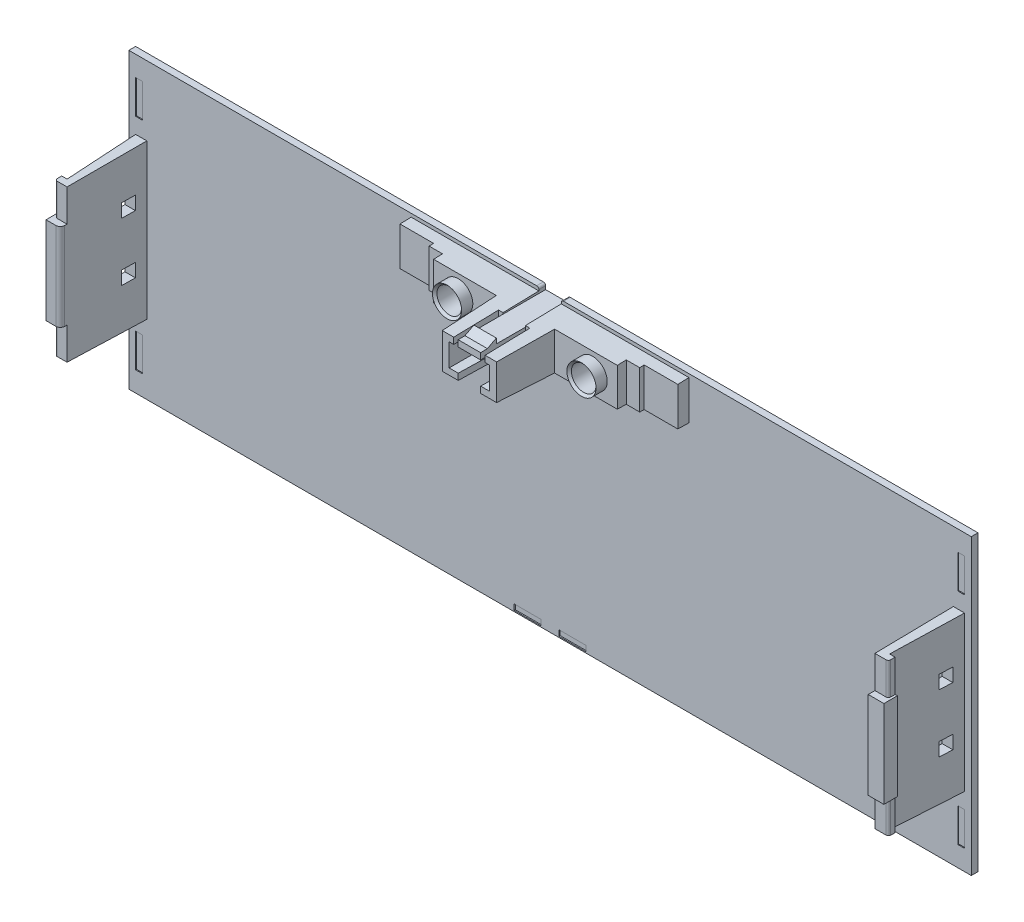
SolidWorks part; units mm, degrees
ref_plane "Plan de face" through (0, 0, 0) normal (0, 0, 1) x (1, 0, 0)
ref_plane "Plan de dessus" through (0, 0, 0) normal (0, 1, 0) x (1, 0, 0)
ref_plane "Plan de droite" through (0, 0, 0) normal (1, 0, 0) x (0, 0, -1)
sketch "Esquisse1" plane through (0, 0, 0) normal (0, 0, 1) x (1, 0, 0)
  line L1 (-94, 32.75) -> (94, 32.75)
  line L2 (-94, 32.75) -> (-94, -32.75)
  line L3 (-94, -32.75) -> (94, -32.75)
  line L4 (94, 32.75) -> (94, -32.75)
  dimension "D1" = 188
  dimension "D2" = 65.5
  dimension "D3" = 94
  dimension "D4" = 32.75
extrude "Extrusion1" add sketch "Esquisse1" along normal blind 1.5
sketch "Esquisse2" plane through (0, 0, 1.5) normal (0, 0, 1) x (1, 0, 0)
  line L0 (0, 49.1948) -> (0, -57.6715) construction
  line L1 (93.5, -17.25) -> (90, -17.25)
  line L2 (-93.5, 17.25) -> (-90, 17.25)
  line L3 (-93.5, 17.25) -> (-93.5, -17.25)
  line L4 (-93.5, -17.25) -> (-90, -17.25)
  line L5 (-90, 17.25) -> (-90, -17.25)
  line L6 (90, 17.25) -> (90, -17.25)
  line L7 (93.5, 17.25) -> (90, 17.25)
  line L8 (93.5, 17.25) -> (93.5, -17.25)
  dimension "D1" = 3.5
  dimension "D2" = 34.5
  dimension "D3" = 90
  dimension "D4" = 17.25
extrude "Extrusion2" add sketch "Esquisse2" along normal blind 19
sketch "Esquisse3" plane through (-93.5, 0, 0) normal (-1, 0, 0) x (0, 0, 1)
  line L0 (34.0005, 0) -> (-10.2246, 0) construction
  line L1 (1.5, 32.75) -> (1.5, -32.75) construction
  line L2 (4, 8) -> (7, 8)
  line L3 (4, 8) -> (4, 5)
  line L4 (4, 5) -> (7, 5)
  line L5 (7, 8) -> (7, 5)
  line L6 (7, -8) -> (7, -5)
  line L7 (4, -5) -> (7, -5)
  line L8 (4, -8) -> (7, -8)
  line L9 (4, -8) -> (4, -5)
  dimension "D1" = 3
  dimension "D2" = 3
  dimension "D3" = 10
  dimension "D4" = 2.5
extrude "Enlèv. mat.-Extru.1" cut sketch "Esquisse3" against normal through all
sketch "Esquisse4" plane through (0, 0, 1.5) normal (0, 0, 1) x (1, 0, 0)
  line L0 (94, 32.75) -> (-94, 32.75) construction
  line L1 (-31, 32) -> (31, 32)
  line L2 (-31, 32) -> (-31, 23.25)
  line L3 (-31, 23.25) -> (31, 23.25)
  line L4 (31, 32) -> (31, 23.25)
  dimension "D1" = 8.75
  dimension "D2" = 62
  dimension "D3" = 31
  dimension "D4" = 0.75
sketch "Esquisse5" plane through (-93.5, 0, 0) normal (-1, 0, 0) x (0, 0, 1)
  line L0 (26.7662, 0) -> (26.9026, 0) construction
  line L1 (26.9026, 0) -> (-9.5421, 0) construction
  line L2 (20.5, 17.25) -> (20.5, -17.25) construction
  line L3 (19, 19.75) -> (25.0059, 19.75)
  line L4 (19, 19.75) -> (19, 9.75)
  line L5 (19, 9.75) -> (25.0059, 9.75)
  line L6 (25.0059, 19.75) -> (25.0059, 9.75)
  line L7 (25.0059, -19.75) -> (25.0059, -9.75)
  line L8 (19, -9.75) -> (25.0059, -9.75)
  line L9 (19, -19.75) -> (25.0059, -19.75)
  line L10 (19, -19.75) -> (19, -9.75)
  dimension "D1" = 9.75
  dimension "D2" = 10
  dimension "D3" = 6.0059
  dimension "D4" = 1.5
extrude "Enlèv. mat.-Extru.2" cut sketch "Esquisse5" against normal through all
draft "Dépouille1" type of draft neutral plane draft angle 1 faces to draft 1 parameters "D1"=1
fillet "Congé2" radius 1 1 edges at (-90.3316, 0, 20.5)
sketch "Esquisse6" plane through (0, -17.25, 0) normal (0, -1, 0) x (1, 0, 0)
  line L0 (-92.5, 1.5) -> (-91.7795, 17.5)
  line L1 (-94, 1.5) -> (94, 1.5) construction
  line L2 (-91.7795, 17.5) -> (-93.5, 17.5)
  line L3 (-93.5, 19) -> (-93.5, 1.5) construction
  line L4 (-93.5, 17.5) -> (-93.5, 1.5)
  line L5 (-93.5, 1.5) -> (-92.5, 1.5)
  line L6 (-90.3055, 19) -> (-90, 1.5) construction
  line L8 (-91.3143, 20.5) -> (-93.5, 20.5) construction
  line L9 (0, -24.7431) -> (0, 42.7766) construction
  line L10 (93.5, 1.5) -> (92.5, 1.5)
  line L11 (92.5, 1.5) -> (91.7795, 17.5)
  line L12 (93.5, 17.5) -> (93.5, 1.5)
  line L13 (91.7795, 17.5) -> (93.5, 17.5)
  dimension "D1" = 1
  dimension "D2" = 1.5
  dimension "D3" = 3
extrude "Enlèv. mat.-Extru.5" cut sketch "Esquisse6" against normal through all
sketch "Esquisse7" plane through (0, -17.25, 0) normal (0, -1, 0) x (1, 0, 0)
  line L0 (0, -5.9465) -> (0, 53.0874) construction
  line L1 (-90.3055, 19) -> (-93.5, 19) construction
  line L2 (-93, 19) -> (-94.3654, 19)
  line L3 (-93, 19) -> (-93, 17.2978)
  line L4 (-93, 17.2978) -> (-94.3654, 17.2978)
  line L5 (-94.3654, 19) -> (-94.3654, 17.2978)
  line L6 (-93.5, 19) -> (-93.5, 17.5) construction
  line L7 (93, 19) -> (93, 17.2978)
  line L8 (93, 17.2978) -> (94.3654, 17.2978)
  line L9 (94.3654, 19) -> (94.3654, 17.2978)
  line L10 (93, 19) -> (94.3654, 19)
  point P9 (-93.5, 18.25)
  dimension "D1" = 1.7022
  dimension "D2" = 0.5
  dimension "D3" = 1.3654
extrude "Enlèv. mat.-Extru.6" cut sketch "Esquisse7" against normal blind 7.5
sketch "Esquisse8" plane through (0, 17.25, 0) normal (0, 1, 0) x (-1, 0, 0)
  line L0 (-90, 19) -> (-93.5, 19) construction
  line L1 (-93, 19) -> (-93.8429, 19)
  line L2 (-93, 19) -> (-93, 16.5648)
  line L3 (-93, 16.5648) -> (-93.8429, 16.5648)
  line L4 (-93.8429, 19) -> (-93.8429, 16.5648)
  line L5 (-93.5, 19) -> (-93.5, 17.5) construction
  line L6 (0, 0) -> (0, 56.5796) construction
  line L7 (93, 16.5648) -> (93.8429, 16.5648)
  line L8 (93, 19) -> (93, 16.5648)
  line L9 (93, 19) -> (93.8429, 19)
  line L10 (93.8429, 19) -> (93.8429, 16.5648)
  dimension "D1" = 2.4352
  dimension "D2" = 0.5
  dimension "D3" = 0.8429
extrude "Enlèv. mat.-Extru.7" cut sketch "Esquisse8" against normal blind 7.5
fillet "Congé3" radius 0.5 2 edges at (-93, 13.5, 19) (-93, -13.5, 19)
draft "Dépouille2" type of draft neutral plane draft angle 1 faces to draft 1 parameters "D1"=1
draft "Dépouille3" type of draft neutral plane draft angle 1 faces to draft 1 parameters "D1"=1
draft "Dépouille4" type of draft neutral plane draft angle 1 faces to draft 1 parameters "D1"=1
draft "Dépouille5" type of draft neutral plane draft angle 1 faces to draft 1 parameters "D1"=1
fillet "Congé4" radius 0.5 1 edges at (93, 13.3473, 19)
fillet "Congé5" radius 0.5 1 edges at (93, -13.3473, 19)
sketch "Esquisse9" plane through (0, 0, 1.5) normal (0, 0, 1) x (1, 0, 0)
  line L0 (0, 0) -> (0, -46.1675) construction
  line L1 (-94, -32.75) -> (94, -32.75) construction
  line L2 (-8, -31.25) -> (-2, -31.25)
  line L3 (-8, -31.25) -> (-8, -32.5)
  line L4 (-8, -32.5) -> (-2, -32.5)
  line L5 (-2, -31.25) -> (-2, -32.5)
  line L6 (2, -31.25) -> (2, -32.5)
  line L7 (8, -31.25) -> (2, -31.25)
  line L8 (8, -31.25) -> (8, -32.5)
  line L9 (8, -32.5) -> (2, -32.5)
  dimension "D1" = 1.25
  dimension "D2" = 6
  dimension "D3" = 0.25
  dimension "D4" = 2
extrude "Enlèv. mat.-Extru.8" cut sketch "Esquisse9" against normal blind 0.25
extrude "Extrusion3" add sketch "Esquisse4" along normal blind 18 contours L2 L3 L4 L1
sketch "Esquisse10" plane through (0, 23.25, 0) normal (0, -1, 0) x (1, 0, 0)
  line L0 (0, 28.6532) -> (0, -3.2422) construction
  line L1 (31, 4) -> (31, 19.5)
  line L2 (31, 19.5) -> (31, 1.5) construction
  line L3 (31, 4) -> (23.5, 4)
  line L4 (23.5, 4) -> (23.5, 5)
  line L5 (23.5, 5) -> (20.5, 5)
  line L6 (20.5, 5) -> (20.5, 7)
  line L7 (20.5, 7) -> (6.5, 7)
  line L8 (6.5, 7) -> (6.5, 19.5)
  line L9 (-31, 19.5) -> (31, 19.5) construction
  line L10 (31, 19.5) -> (6.5, 19.5)
  line L11 (-94, 1.5) -> (94, 1.5) construction
  line L12 (-31, 19.5) -> (-6.5, 19.5)
  line L13 (-6.5, 7) -> (-6.5, 19.5)
  line L14 (-20.5, 7) -> (-6.5, 7)
  line L15 (-20.5, 5) -> (-20.5, 7)
  line L16 (-31, 4) -> (-31, 19.5)
  line L17 (-23.5, 5) -> (-20.5, 5)
  line L18 (-31, 4) -> (-23.5, 4)
  line L19 (-23.5, 4) -> (-23.5, 5)
  dimension "D1" = 7.5
  dimension "D2" = 14
  dimension "D3" = 3
  dimension "D4" = 5.5
  dimension "D5" = 3.5
  dimension "D6" = 2.5
extrude "Enlèv. mat.-Extru.9" cut sketch "Esquisse10" against normal through all
sketch "Esquisse11" plane through (0, 0, 7) normal (0, 0, 1) x (1, 0, 0)
  line L0 (0, 0) -> (0, 44.6077) construction
  line L1 (20.5, 32) -> (6.5, 32) construction
  line L2 (31, 32) -> (23.5, 32) construction
  circle A0 centre (15, 27.625) radius 3.25
  circle A1 centre (-15, 27.625) radius 3.25
  dimension "D1" = 6.5
  dimension "D2" = 15
  dimension "D3" = 4.375
extrude "Extrusion4" add sketch "Esquisse11" along normal blind 2.5
draft "Dépouille7" type of draft neutral plane draft angle 2 faces to draft 1 parameters "D1"=2
draft "Dépouille8" type of draft neutral plane draft angle 2 faces to draft 1 parameters "D1"=2
sketch "Esquisse17" plane through (0, 0, 0) normal (0, 0, -1) x (-1, 0, 0)
  line L0 (0, 0) -> (0, 40.1138) construction
  line L1 (-43.1897, 27.625) -> (8.6403, 27.625) construction
  line L2 (-94, 32.75) -> (94, 32.75) construction
  line L3 (24.5, 30.625) -> (24.5, 24.625)
  line L4 (-29.5, 30.625) -> (-24.5, 30.625)
  line L5 (-29.5, 30.625) -> (-29.5, 24.625)
  line L6 (-29.5, 24.625) -> (-24.5, 24.625)
  line L7 (-24.5, 30.625) -> (-24.5, 24.625)
  line L8 (29.5, 24.625) -> (24.5, 24.625)
  line L9 (29.5, 30.625) -> (24.5, 30.625)
  line L10 (29.5, 30.625) -> (29.5, 24.625)
  dimension "D1" = 5.125
  dimension "D2" = 5
  dimension "D3" = 6
  dimension "D4" = 3
  dimension "D5" = 24.5
extrude "Enlèv. mat.-Extru.17" cut sketch "Esquisse17" against normal blind 2.5
sketch "Esquisse18" plane through (0, 0, 0) normal (0, 0, -1) x (-1, 0, 0)
  line L0 (0, 0) -> (0, 42.2606) construction
  line L1 (-27.4464, 27.625) -> (4.1422, 27.625) construction
  line L3 (-94, 32.75) -> (94, 32.75) construction
  line L4 (-24.5, 24.625) -> (-24.5, 30.625) construction
  line L5 (-23.5, 30.625) -> (-6.5, 30.625)
  line L6 (-23.5, 30.625) -> (-23.5, 24.625)
  line L7 (-23.5, 24.625) -> (-6.5, 24.625)
  line L8 (-6.5, 30.625) -> (-6.5, 24.625)
  line L9 (6.5, 30.625) -> (6.5, 24.625)
  line L10 (23.5, 24.625) -> (6.5, 24.625)
  line L11 (23.5, 30.625) -> (6.5, 30.625)
  line L12 (23.5, 30.625) -> (23.5, 24.625)
  dimension "D1" = 5.125
  dimension "D2" = 1
  dimension "D3" = 17
  dimension "D4" = 6
  dimension "D5" = 3
extrude "Enlèv. mat.-Extru.18" cut sketch "Esquisse18" against normal blind 2.5
sketch "Esquisse19" plane through (0, 0, 2.5) normal (0, 0, -1) x (-1, 0, 0)
  line L0 (0, 0) -> (0, 41.545) construction
  line L1 (-24.5, 27.625) -> (2.5066, 27.625) construction
  line L2 (-24.5, 24.625) -> (-24.5, 30.625) construction
  line L3 (6.5, 30.625) -> (6.5, 24.625)
  line L4 (-22, 30.625) -> (-6.5, 30.625)
  line L5 (-22, 30.625) -> (-22, 24.625)
  line L6 (-22, 24.625) -> (-6.5, 24.625)
  line L7 (-6.5, 30.625) -> (-6.5, 24.625)
  line L8 (22, 30.625) -> (6.5, 30.625)
  line L9 (22, 24.625) -> (6.5, 24.625)
  line L10 (22, 30.625) -> (22, 24.625)
  dimension "D1" = 6
  dimension "D2" = 3
  dimension "D3" = 15.5
  dimension "D4" = 13
extrude "Enlèv. mat.-Extru.22" cut sketch "Esquisse19" against normal blind 1 contours L3 L9 L10 L8 | L5 L6 L7 L4
sketch "Esquisse21" plane through (0, 0, 3.5) normal (0, 0, -1) x (-1, 0, 0)
  line L0 (0, 0) -> (0, 30.8628) construction
  line L1 (-24.5, 27.625) -> (-3.4223, 27.625) construction
  line L2 (-24.5, 24.625) -> (-24.5, 30.625) construction
  line L3 (6.5, 30.625) -> (6.5, 24.625)
  line L4 (-19, 30.625) -> (-6.5, 30.625)
  line L5 (-19, 30.625) -> (-19, 24.625)
  line L6 (-19, 24.625) -> (-6.5, 24.625)
  line L7 (-6.5, 30.625) -> (-6.5, 24.625)
  line L8 (19, 24.625) -> (6.5, 24.625)
  line L9 (19, 30.625) -> (6.5, 30.625)
  line L10 (19, 30.625) -> (19, 24.625)
  dimension "D1" = 6
  dimension "D2" = 3
  dimension "D3" = 12.5
  dimension "D4" = 13
extrude "Enlèv. mat.-Extru.23" cut sketch "Esquisse21" against normal blind 1
fillet "Congé6" radius 1 1 edges
fillet "Congé7" radius 1 1 edges
fillet "Congé8" radius 1 1 edges
fillet "Congé9" radius 1 1 edges
draft "Dépouille9" type of draft neutral plane draft angle 1.4 faces to draft 1 parameters "D1"=1.4
draft "Dépouille10" type of draft neutral plane draft angle 1.4 faces to draft 1 parameters "D1"=1.4
sketch "Esquisse22" plane through (0, 0, 0) normal (0, 0, -1) x (-1, 0, 0)
  line L0 (0, 0) -> (0, 34.113) construction
  line L1 (-6.5, 27.625) -> (7.1768, 27.625) construction
  line L2 (-6.5, 24.625) -> (-6.5, 30.625) construction
  line L4 (-5, 30.625) -> (5, 30.625)
  line L5 (-5, 30.625) -> (-5, 24.625)
  line L6 (-5, 24.625) -> (5, 24.625)
  line L7 (5, 30.625) -> (5, 24.625)
  dimension "D1" = 6
  dimension "D2" = 6
  dimension "D3" = 10
  dimension "D4" = 5
sketch "Esquisse23" plane through (0, 0, 9.5) normal (0, 0, 1) x (1, 0, 0)
  line L0 (0, 0) -> (0, 34.113) construction
  line L1 (94, 32.75) -> (-94, 32.75) construction
  circle A0 centre (-15, 27.625) radius 2.75
  point P2 (-19.6371, 27.5271)
  dimension "D3" = 5.5
  dimension "D1" = 15
  dimension "D2" = 5.125
extrude "Enlèv. mat.-Extru.25" cut sketch "Esquisse23" against normal through all
sketch "Esquisse24" plane through (0, 0, 9.5) normal (0, 0, 1) x (1, 0, 0)
  line L0 (0, 0) -> (0, 34.113) construction
  line L1 (94, 32.75) -> (-94, 32.75) construction
  circle A0 centre (15, 27.625) radius 2.75
  dimension "D3" = 5.5
  dimension "D1" = 15
  dimension "D2" = 5.125
extrude "Enlèv. mat.-Extru.26" cut sketch "Esquisse24" against normal through all
extrude "Enlèv. mat.-Extru.28" cut sketch "Esquisse22" against normal through all contours L5 L6 L7 L4
draft "Dépouille13" type of draft neutral plane draft angle 1.4 faces to draft 1 parameters "D1"=1.4
draft "Dépouille14" type of draft neutral plane draft angle 1.4 faces to draft 2 parameters "D1"=1.4
draft "Dépouille15" type of draft neutral plane draft angle 1.4 faces to draft 1 parameters "D1"=1.4
chamfer "Chanfrein4" distance 1.5 angle 45 1 edges at (5, 27.625, 0)
chamfer "Chanfrein5" distance 1.5 angle 45 1 edges at (-5, 27.625, 0)
sketch "Esquisse26" plane through (0, 23.1995, -0.567) normal (0, -0.9997, 0.0244) x (1, 0, 0)
  line L0 (0, 22.6328) -> (0, 22.5807) construction
  line L1 (0, 22.5807) -> (0, 0) construction
  line L2 (-6.0635, 20.073) -> (6.0635, 20.073) construction
  line L3 (-2.5, 25.4597) -> (2.5, 25.4597)
  line L4 (-2.5, 25.4597) -> (-2.5, 12.073)
  line L5 (-2.5, 12.073) -> (2.5, 12.073)
  line L6 (2.5, 25.4597) -> (2.5, 12.073)
  dimension "D1" = 5
  dimension "D2" = 2.5
  dimension "D3" = 13.3867
  dimension "D4" = 8
extrude "Enlèv. mat.-Extru.29" cut sketch "Esquisse26" against normal blind 2
sketch "Esquisse29" plane through (0, 32.0175, 0.7825) normal (0, 0.9997, 0.0244) x (-1, 0, 0)
  line L0 (0, -1.3853) -> (0, 20.976) construction
  line L2 (3.5, 8.7231) -> (2.5, 8.7231)
  line L3 (3.5, 8.7231) -> (3.5, 26.9468)
  line L4 (3.5, 26.9468) -> (2.5, 26.9468)
  line L5 (2.5, 8.7231) -> (2.5, 26.9468)
  line L6 (6.0635, 18.7231) -> (-6.0635, 18.7231) construction
  line L7 (-3.5, 26.9468) -> (-2.5, 26.9468)
  line L8 (-2.5, 8.7231) -> (-2.5, 26.9468)
  line L9 (-3.5, 8.7231) -> (-3.5, 26.9468)
  line L10 (-3.5, 8.7231) -> (-2.5, 8.7231)
  dimension "D1" = 1
  dimension "D2" = 18.2237
  dimension "D3" = 10
  dimension "D4" = 5
extrude "Enlèv. mat.-Extru.31" cut sketch "Esquisse29" against normal blind 2
sketch "Esquisse30" plane through (0, 0, 0) normal (0, 0, -1) x (-1, 0, 0)
  line L0 (0, 0) -> (0, 39.714) construction
  line L2 (-94, 32.75) -> (94, 32.75) construction
  line L3 (-2.5, 33.2378) -> (2.5, 33.2378)
  line L4 (-2.5, 33.2378) -> (-2.5, 31.5)
  line L5 (-2.5, 31.5) -> (2.5, 31.5)
  line L7 (2.5, 33.2378) -> (2.5, 31.5)
  dimension "D1" = 1.25
  dimension "D2" = 1.7378
  dimension "D3" = 5
  dimension "D4" = 2.5
extrude "Enlèv. mat.-Extru.32" cut sketch "Esquisse30" against normal blind 16
fillet "Congé10" radius 0.5 1 edges at (2.5, 32.75, 0.75)
fillet "Congé11" radius 0.5 1 edges at (-2.5, 32.75, 0.75)
ref_plane "Plan1" through (-2.5, 0, 0) normal (-1, 0, 0) x (0, 0, 1)
sketch "Esquisse31" plane through (-2.5, 0, 0) normal (-1, 0, 0) x (0, 0, 1)
  line L0 (16, 31.6456) -> (18, 31.5967)
  line L1 (19.5, 31.5601) -> (16, 31.6456) construction
  line L3 (16, 31.6456) -> (16, 32.6456)
  line L4 (16, 32.6456) -> (18, 31.5967)
  dimension "D1" = 2
  dimension "D2" = 1
extrude "Extrusion5" add sketch "Esquisse31" against normal blind 5
sketch "Esquisse32" plane through (0, 0, 1.5) normal (0, 0, 1) x (1, 0, 0)
  line L0 (-3.9356, 0) -> (102.9308, 0) construction
  line L1 (0, 49.9065) -> (0, -45.7585) construction
  line L2 (94, -32.75) -> (94, 32.75) construction
  line L3 (91, 28.25) -> (92.5, 28.25)
  line L4 (91, 28.25) -> (91, 20.75)
  line L5 (91, 20.75) -> (92.5, 20.75)
  line L6 (92.5, 28.25) -> (92.5, 20.75)
  line L7 (94, 32.75) -> (3, 32.75) construction
  line L8 (91, -28.25) -> (92.5, -28.25)
  line L9 (92.5, -28.25) -> (92.5, -20.75)
  line L10 (91, -28.25) -> (91, -20.75)
  line L11 (91, -20.75) -> (92.5, -20.75)
  line L12 (-91, 20.75) -> (-92.5, 20.75)
  line L13 (-92.5, 28.25) -> (-92.5, 20.75)
  line L14 (-91, 28.25) -> (-92.5, 28.25)
  line L15 (-91, 28.25) -> (-91, 20.75)
  line L16 (-92.5, -28.25) -> (-92.5, -20.75)
  line L17 (-91, -20.75) -> (-92.5, -20.75)
  line L18 (-91, -28.25) -> (-92.5, -28.25)
  line L19 (-91, -28.25) -> (-91, -20.75)
  dimension "D1" = 1.5
  dimension "D2" = 1.5
  dimension "D3" = 4.5
  dimension "D4" = 7.5
extrude "Enlèv. mat.-Extru.33" cut sketch "Esquisse32" against normal blind 0.2
chamfer "Chanfrein6" distance 0.5 angle 45 1 edges at (17.75, 27.625, 9.5)
chamfer "Chanfrein7" distance 0.5 angle 45 1 edges at (-12.25, 27.625, 9.5)
sketch "Esquisse34" plane through (0, 0, 4.5) normal (0, 0, -1) x (-1, 0, 0)
  line L0 (15, 30.9868) -> (15, 24.1075) construction
  line L1 (11.3336, 27.5471) -> (18.4978, 27.5471) construction
  line L5 (6.5, 24.625) -> (23.5, 24.625) construction
  line L6 (15, 30.6239) -> (15, 30.375)
  line L7 (15, 24.875) -> (15, 24.625)
  arc A0 (15, 30.375) -> (15, 24.875) centre (15, 27.625) cw
  circle A1 centre (15, 27.625) radius 2.75 construction
  arc A2 (15, 30.6239) -> (15, 24.625) centre (15.0569, 27.6244) cw
revolve "Révolution1" add sketch "Esquisse34" angle 180 about L0
sketch "Esquisse35" plane through (0, 0, 4.5) normal (0, 0, -1) x (-1, 0, 0)
  line L0 (-15, 24.625) -> (-15, 31.6404) construction
  line L1 (-23.5, 24.625) -> (-6.5, 24.625) construction
  line L2 (-11.75, 27.625) -> (-18.25, 27.625) construction
  line L3 (-6.5, 30.625) -> (-23.5, 30.625) construction
  line L4 (-15, 30.375) -> (-15, 30.625)
  line L5 (-15, 24.875) -> (-15, 24.625)
  circle A0 centre (-15, 27.625) radius 3.25 construction
  arc A1 (-15, 30.375) -> (-15, 24.875) centre (-15, 27.625) cw
  circle A2 centre (-15, 27.625) radius 2.75 construction
  arc A3 (-15, 30.625) -> (-15, 24.625) centre (-14.8526, 27.625) cw
revolve "Révolution3" add sketch "Esquisse35" angle 180 about L0
